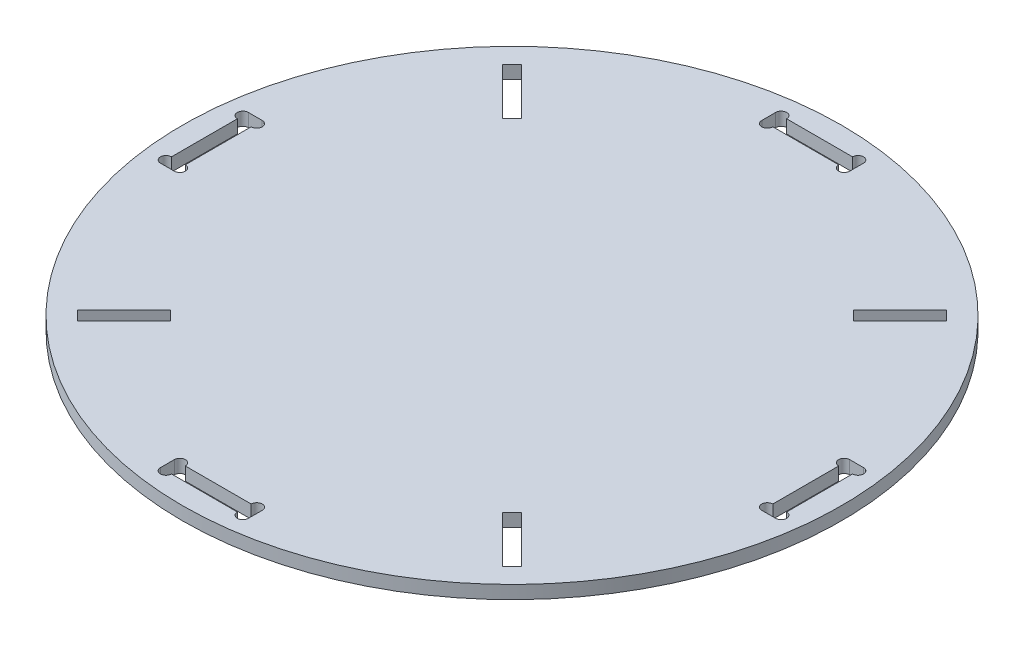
SolidWorks part; units mm, degrees
ref_plane "Front" through (0, 0, 0) normal (0, 0, 1) x (1, 0, 0)
ref_plane "Top" through (0, 0, 0) normal (0, 1, 0) x (1, 0, 0)
ref_plane "Right" through (0, 0, 0) normal (1, 0, 0) x (0, 0, -1)
sketch "Sketch1" plane through (0, 0, 0) normal (0, 1, 0) x (1, 0, 0)
  circle A0 centre (0, 0) radius 300
  dimension "D1" = 600
extrude "Boss-Extrude2" add sketch "Sketch1" along normal blind 12 contours A0
sketch "Sketch3" plane through (0, 12, 0) normal (0, 1, 0) x (1, 0, 0)
  line L0 (0, 300) -> (0, -300) construction
  line L1 (-300, 0) -> (300, 0) construction
  line L2 (-30, 280) -> (30, 280)
  line L3 (-30, 273.7) -> (30, 273.7) construction
  line L4 (-30, 267.4) -> (30, 267.4)
  line L5 (-39.9996, 280) -> (-39.9996, 267.4)
  line L6 (39.9996, 280) -> (39.9996, 267.4)
  line L7 (280, 39.9996) -> (267.4, 39.9996)
  line L8 (280, 30) -> (280, -30)
  line L9 (267.4, 30) -> (267.4, -30)
  line L10 (280, -39.9996) -> (267.4, -39.9996)
  line L11 (39.9996, -280) -> (39.9996, -267.4)
  line L12 (30, -280) -> (-30, -280)
  line L13 (30, -267.4) -> (-30, -267.4)
  line L14 (-39.9996, -280) -> (-39.9996, -267.4)
  line L15 (-280, -39.9996) -> (-267.4, -39.9996)
  line L16 (-280, -30) -> (-280, 30)
  line L17 (-267.4, -30) -> (-267.4, 30)
  line L18 (-280, 39.9996) -> (-267.4, 39.9996)
  circle A0 centre (0, 0) radius 300 construction
  arc A1 (280, 30) -> (280, 39.9996) centre (280.044, 34.9998) ccw
  arc A2 (-30, 280) -> (-39.9996, 280) centre (-34.9998, 280.044) ccw
  arc A3 (-30, 267.4) -> (-39.9996, 267.4) centre (-34.9998, 267.356) cw
  arc A4 (30, 267.4) -> (39.9996, 267.4) centre (34.9998, 267.356) ccw
  arc A7 (30, 280) -> (39.9996, 280) centre (34.9998, 280.044) cw
  arc A8 (267.4, 30) -> (267.4, 39.9996) centre (267.356, 34.9998) cw
  arc A9 (280, -30) -> (280, -39.9996) centre (280.044, -34.9998) cw
  arc A10 (267.4, -30) -> (267.4, -39.9996) centre (267.356, -34.9998) ccw
  arc A11 (30, -280) -> (39.9996, -280) centre (34.9998, -280.044) ccw
  arc A12 (30, -267.4) -> (39.9996, -267.4) centre (34.9998, -267.356) cw
  arc A13 (-30, -280) -> (-39.9996, -280) centre (-34.9998, -280.044) cw
  arc A14 (-30, -267.4) -> (-39.9996, -267.4) centre (-34.9998, -267.356) ccw
  arc A15 (-280, -30) -> (-280, -39.9996) centre (-280.044, -34.9998) ccw
  arc A16 (-267.4, -30) -> (-267.4, -39.9996) centre (-267.356, -34.9998) cw
  arc A17 (-280, 30) -> (-280, 39.9996) centre (-280.044, 34.9998) cw
  arc A18 (-267.4, 30) -> (-267.4, 39.9996) centre (-267.356, 34.9998) ccw
  point P12 (0, 280)
  point P64 (0, 0)
  dimension "D4" = 5
  dimension "D1" = 60
  dimension "D3" = 6.3
  dimension "D5" = 4
extrude "Cut-Extrude1" cut sketch "Sketch3" against normal through all
sketch "Sketch4" plane through (0, 12, 0) normal (0, 1, 0) x (1, 0, 0)
  line L0 (0, 300) -> (0, -300) construction
  line L1 (-300, 0) -> (300, 0) construction
  line L2 (-212.132, 212.132) -> (212.132, -212.132) construction
  line L3 (212.132, 212.132) -> (-212.132, -212.132) construction
  line L20 (193.4067, 202.2455) -> (202.2455, 193.4067)
  line L21 (202.2455, 193.4067) -> (159.8191, 150.9803)
  line L22 (159.8191, 150.9803) -> (150.9803, 159.8191)
  line L23 (150.9803, 159.8191) -> (193.4067, 202.2455)
  line L24 (-159.8191, -150.9803) -> (-202.2455, -193.4067)
  line L29 (-150.9803, -159.8191) -> (-159.8191, -150.9803)
  line L30 (-193.4067, -202.2455) -> (-150.9803, -159.8191)
  line L31 (-202.2455, -193.4067) -> (-193.4067, -202.2455)
  line L32 (202.2455, -193.4067) -> (193.4067, -202.2455)
  line L33 (193.4067, -202.2455) -> (150.9803, -159.8191)
  line L34 (150.9803, -159.8191) -> (159.8191, -150.9803)
  line L35 (159.8191, -150.9803) -> (202.2455, -193.4067)
  line L36 (-202.2455, 193.4067) -> (-193.4067, 202.2455)
  line L37 (-193.4067, 202.2455) -> (-150.9803, 159.8191)
  line L38 (-150.9803, 159.8191) -> (-159.8191, 150.9803)
  line L39 (-159.8191, 150.9803) -> (-202.2455, 193.4067)
  circle A0 centre (0, 0) radius 300 construction
  circle A4 centre (0, 0) radius 275
  circle A5 centre (0, 0) radius 275 construction
  point P33 (0, 0)
  point P39 (0, 0)
  point P42 (197.8261, 197.8261)
  dimension "D1" = 45
  dimension "D3" = 45
  dimension "D4" = 12.5
  dimension "D5" = 559.5367
  dimension "D2" = 25
extrude "Cut-Extrude2" cut sketch "Sketch4" against normal through all
